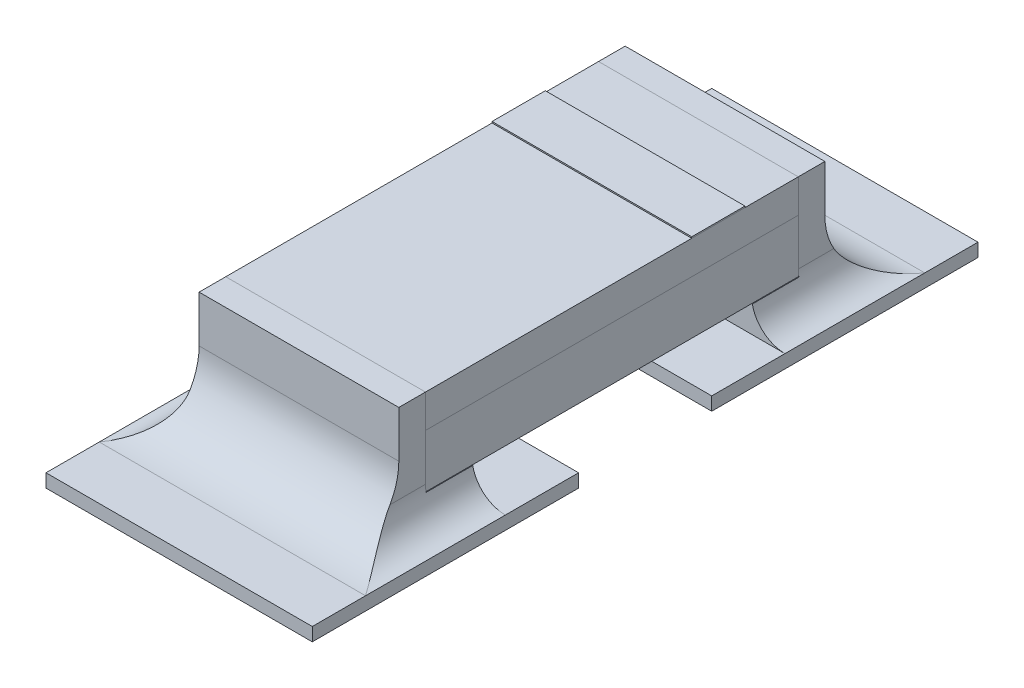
SolidWorks part; units mm, degrees
ref_plane "Front Plane" through (0, 0, 0) normal (0, 0, 1) x (1, 0, 0)
ref_plane "Top Plane" through (0, 0, 0) normal (0, 1, 0) x (1, 0, 0)
ref_plane "Right Plane" through (0, 0, 0) normal (1, 0, 0) x (0, 0, -1)
sketch "Sketch1" plane through (0, 0, 0) normal (0, 0, 1) x (1, 0, 0)
  line L0 (0, -55) -> (0, 55) construction
  line L1 (-0.75, 0.7) -> (0.75, 0.7)
  line L2 (-0.75, 0.7) -> (-0.75, 0.3)
  line L3 (-0.75, 0.3) -> (0.75, 0.3)
  line L4 (0.75, 0.7) -> (0.75, 0.3)
  line L5 (55, 0) -> (-55, 0) construction
  dimension "D1" = 1.5
  dimension "D2" = 0.75
  dimension "D3" = 0.3
  dimension "D4" = 0.4
extrude "Boss-Extrude1" add sketch "Sketch1" along normal mid plane 2.8
sketch "Sketch3" plane through (0, 0, 0) normal (1, 0, 0) x (0, 0, -1)
  line L0 (-1.4, 0.95) -> (-1.6, 0.95)
  line L1 (-1.6, 0.95) -> (-1.6, 0.1)
  line L2 (-1.6, 0.1) -> (-1.05, 0.1)
  line L3 (-1.05, 0.1) -> (-1.05, 0.3)
  line L4 (-1.4, 0.3) -> (1.4, 0.3) construction
  line L5 (-1.05, 0.3) -> (-1.4, 0.3)
  line L6 (-1.4, 0.3) -> (-1.4, 0.95)
  line L7 (1.4, 0.95) -> (1.6, 0.95)
  line L8 (1.6, 0.95) -> (1.6, 0.1)
  line L9 (1.6, 0.1) -> (1.05, 0.1)
  line L10 (1.05, 0.1) -> (1.05, 0.3)
  line L11 (1.05, 0.3) -> (1.4, 0.3)
  line L12 (1.4, 0.3) -> (1.4, 0.95)
  line L13 (55, 0) -> (-55, 0) construction
  dimension "D1" = 0.2
  dimension "D2" = 0.55
  dimension "D3" = 0.95
extrude "Boss-Extrude2" add sketch "Sketch3" along normal mid plane 1.5 separate body
sketch "Sketch5" plane through (0, 0, 0) normal (0, 0, 1) x (1, 0, 0)
  line L0 (-0.75, 0.95) -> (-0.75, 0.1) construction
  line L1 (0.75, 0.7) -> (-0.75, 0.7)
  line L2 (0.75, 0.7) -> (0.75, 0.95)
  line L3 (0.75, 0.95) -> (-0.75, 0.95)
  line L4 (-0.75, 0.7) -> (-0.75, 0.95)
  dimension "D1" = 0.25
extrude "Boss-Extrude4" add sketch "Sketch5" along normal mid plane 2.8 separate body
sketch "Sketch4" plane through (0, 0, 0) normal (0, 1, 0) x (1, 0, 0)
  line L1 (-1, 2.5) -> (1, 2.5)
  line L2 (-1, 2.5) -> (-1, 0.5)
  line L3 (-1, 0.5) -> (1, 0.5)
  line L4 (1, 2.5) -> (1, 0.5)
  line L5 (-1, -0.5) -> (1, -0.5)
  line L6 (-1, -0.5) -> (-1, -2.5)
  line L7 (-1, -2.5) -> (1, -2.5)
  line L8 (1, -0.5) -> (1, -2.5)
  line L10 (0, 0.5) -> (0, -0.5) construction
  dimension "D1" = 2
  dimension "D3" = 3
  dimension "D6" = 2
extrude "Boss-Extrude3" add sketch "Sketch4" along normal blind 0.1
sketch "Sketch6" plane through (0, 0.95, 0) normal (0, 1, 0) x (1, 0, 0)
  line L0 (-0.75, -1.4) -> (-0.75, 1.4) construction
  line L1 (-0.75, 1) -> (0.75, 1)
  line L2 (-0.75, 1) -> (-0.75, 0.6)
  line L3 (-0.75, 0.6) -> (0.75, 0.6)
  line L4 (0.75, 1) -> (0.75, 0.6)
  line L5 (0.75, -1.4) -> (0.75, 1.4) construction
  line L6 (-0.528, 0) -> (0.528, 0) construction
  dimension "D1" = 0.4
  dimension "D2" = 1
extrude "Boss-Extrude5" add sketch "Sketch6" along normal blind 0.01 separate body
fillet "Fillet1" radius 0.5 1 edges at (0, 0.1, 1.6)
fillet "Fillet2" radius 0.5 1 edges at (0, 0.1, -1.6)
fillet "Fillet3" radius 0.25 2 edges at (0.75, 0.1, -1.575) (-0.75, 0.1, -1.575)
fillet "Fillet4" radius 0.25 2 edges at (-0.75, 0.1, 1.575) (0.75, 0.1, 1.575)
